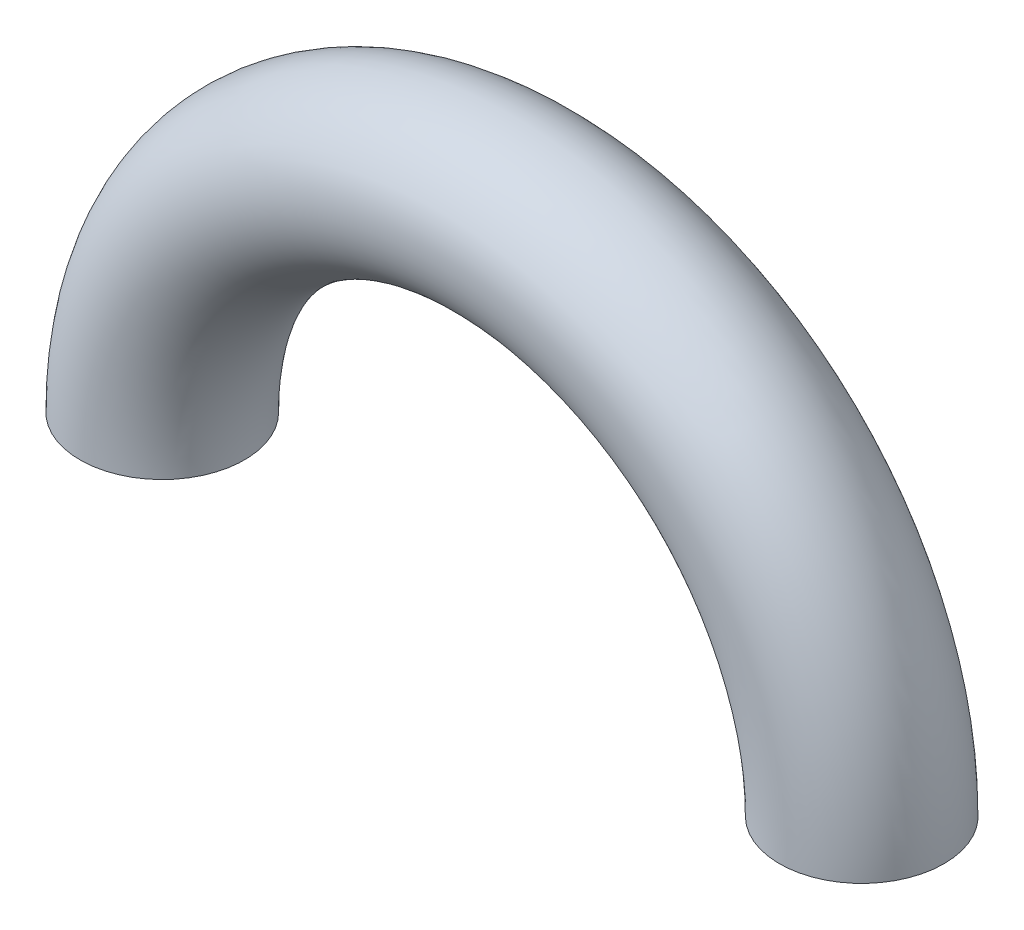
SolidWorks part; units mm, degrees
ref_plane "Vorderseite" through (0, 0, 0) normal (0, 0, 1) x (1, 0, 0)
ref_plane "oben" through (0, 0, 0) normal (0, 1, 0) x (1, 0, 0)
ref_plane "rechts" through (0, 0, 0) normal (1, 0, 0) x (0, 0, -1)
sketch "Skizze1" plane through (0, 0, 0) normal (0, 0, 1) x (1, 0, 0)
  line L0 (-17.791, 0) -> (16.6315, 0) construction
  arc A0 (17, 0) -> (-17, 0) centre (0, 0) ccw
  dimension "Øm" = 34
sketch "Skizze2" plane through (0, 0, 0) normal (0, 1, 0) x (1, 0, 0)
  line L0 (-17.791, 0) -> (16.6315, 0) construction
  circle A0 centre (17, 0) radius 4
  dimension "d" = 8
sweep "Basis-Austragung" add profiles "Skizze2" path "Skizze1"
